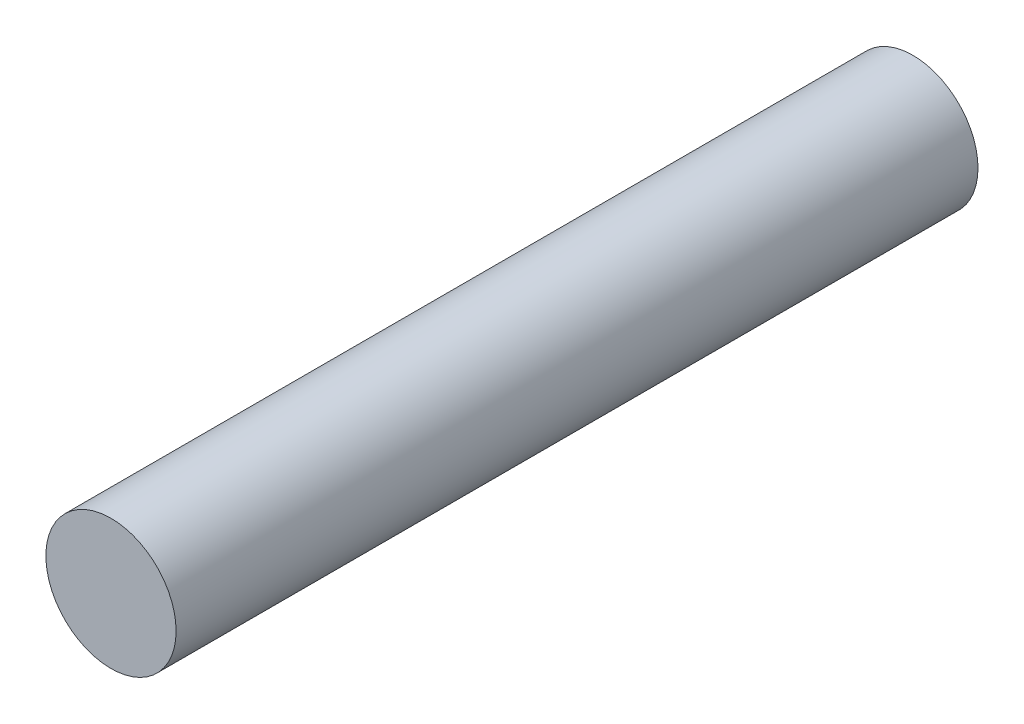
SolidWorks part; units mm, degrees
ref_plane "Plan de face" through (0, 0, 0) normal (0, 0, 1) x (1, 0, 0)
ref_plane "Plan de dessus" through (0, 0, 0) normal (0, 1, 0) x (1, 0, 0)
ref_plane "Plan de droite" through (0, 0, 0) normal (1, 0, 0) x (0, 0, -1)
sketch "Esquisse1" plane through (0, 0, 0) normal (0, 0, 1) x (1, 0, 0)
  circle A0 centre (0, 0) radius 3.8
  dimension "D1" = 7.6
extrude "Boss.-Extru.1" add sketch "Esquisse1" along normal blind 46.8
